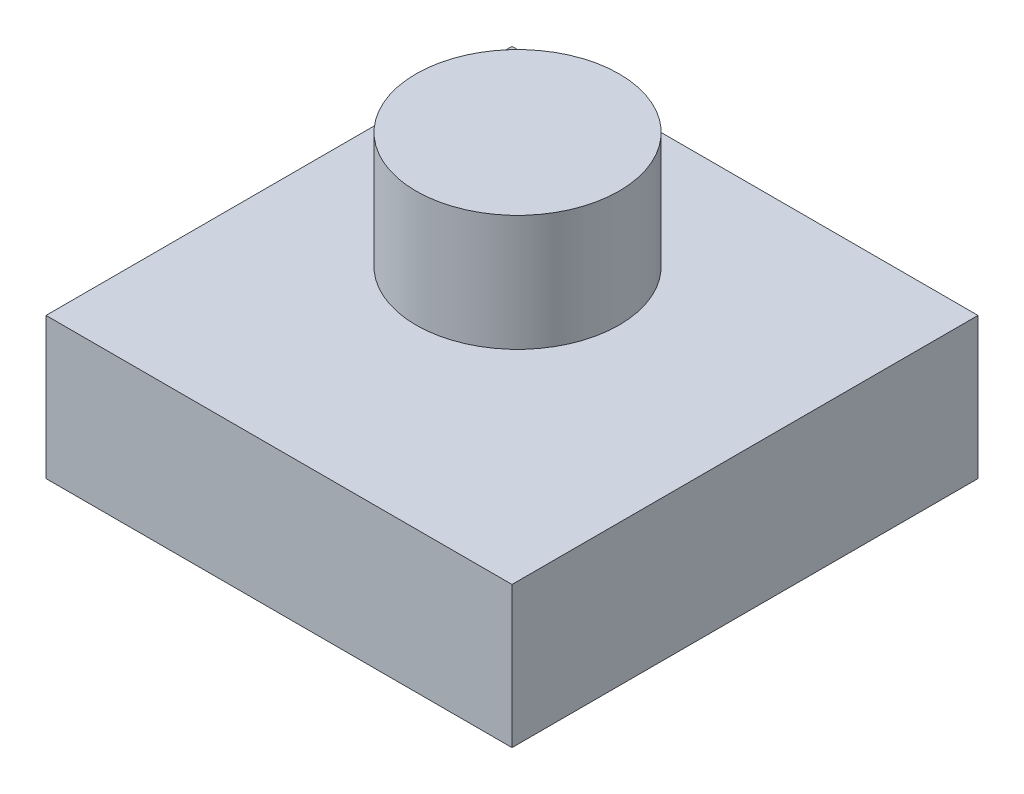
SolidWorks part; units mm, degrees
ref_plane "Front Plane" through (0, 0, 0) normal (0, 0, 1) x (1, 0, 0)
ref_plane "Top Plane" through (0, 0, 0) normal (0, 1, 0) x (1, 0, 0)
ref_plane "Right Plane" through (0, 0, 0) normal (1, 0, 0) x (0, 0, -1)
sketch "Sketch1" plane through (0, 0, 0) normal (0, 1, 0) x (1, 0, 0)
  line L0 (48.7636, -48.7636) -> (-48.7636, 48.7636) construction
  line L1 (-48.7636, 48.7636) -> (48.7636, 48.7636)
  line L2 (-48.7636, 48.7636) -> (-48.7636, -48.7636)
  line L3 (-48.7636, -48.7636) -> (48.7636, -48.7636)
  line L4 (48.7636, 48.7636) -> (48.7636, -48.7636)
extrude "Extrude1" add sketch "Sketch1" along normal blind 29.5775
sketch "Sketch2" plane through (0, 29.5775, 0) normal (0, 1, 0) x (-1, 0, 0)
  circle A0 centre (8.2833, -9.453) radius 21.2536
extrude "Extrude2" add sketch "Sketch2" along normal blind 24.2905
